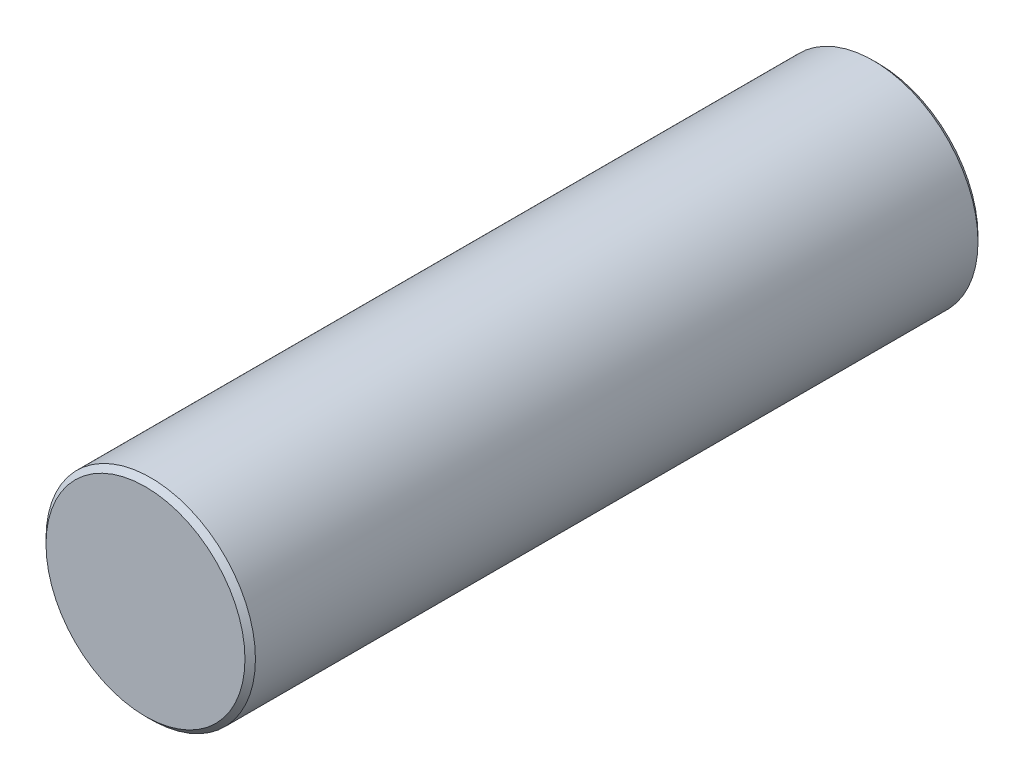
SolidWorks part; units mm, degrees
ref_plane "Face" through (0, 0, 0) normal (0, 0, 1) x (1, 0, 0)
ref_plane "Dessus" through (0, 0, 0) normal (0, 1, 0) x (1, 0, 0)
ref_plane "Droite" through (0, 0, 0) normal (1, 0, 0) x (0, 0, -1)
sketch "Esquisse1" plane through (0, 0, 0) normal (0, 0, 1) x (1, 0, 0)
  circle A0 centre (0, 0) radius 2
  dimension "D1" = 4
extrude "Base-Extrusion" add sketch "Esquisse1" against normal blind 14
chamfer "Chanfrein1" distance 0.1 angle 45
